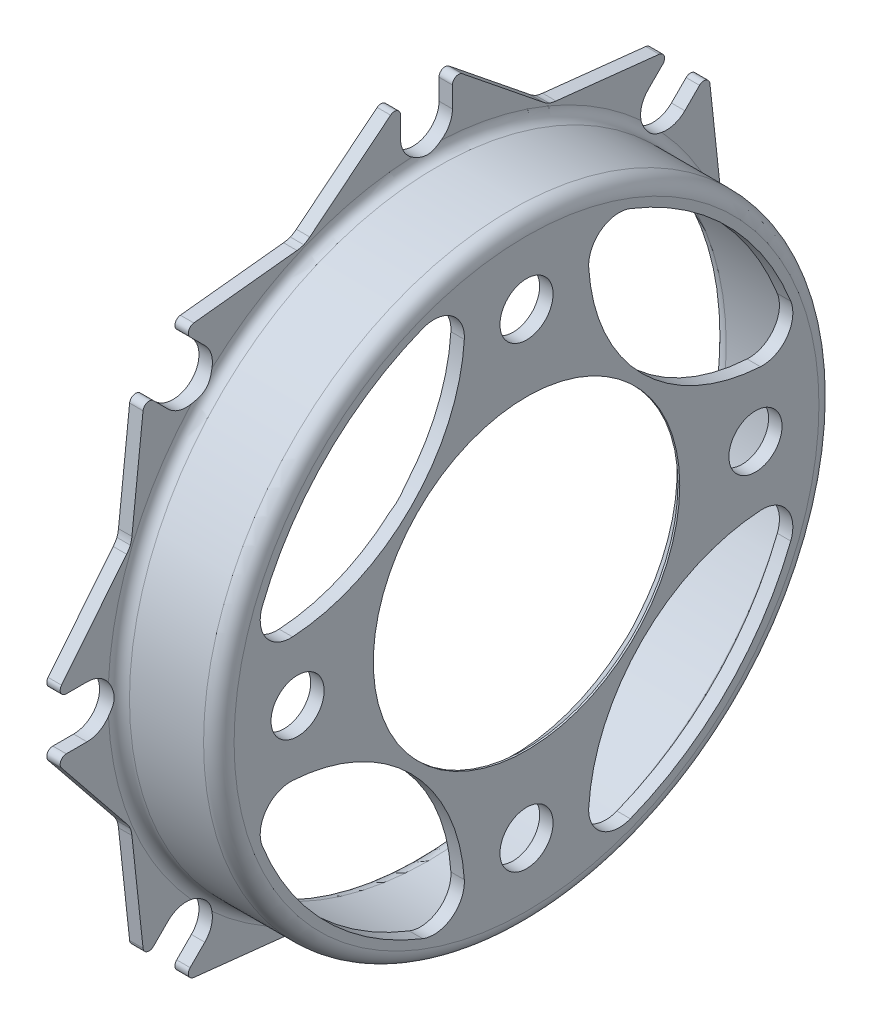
SolidWorks part; units mm, degrees
ref_plane "Front Plane" through (0, 0, 0) normal (0, 0, 1) x (1, 0, 0)
ref_plane "Top Plane" through (0, 0, 0) normal (0, 1, 0) x (1, 0, 0)
ref_plane "Right Plane" through (0, 0, 0) normal (1, 0, 0) x (0, 0, -1)
sketch "Sketch1" plane through (0, 0, 0) normal (0, 0, 1) x (1, 0, 0)
  line L0 (20.8102, 34.1272) -> (20.8102, 59.7535)
  line L1 (18.5877, 61.976) -> (3.175, 61.976)
  line L2 (0, 65.151) -> (0, 88.9)
  line L3 (0, 88.9) -> (2.794, 88.9)
  line L4 (2.794, 88.9) -> (2.794, 66.2305)
  line L5 (5.0165, 64.008) -> (20.4292, 64.008)
  line L6 (23.6042, 60.833) -> (23.6042, 31.877)
  line L7 (23.6042, 31.877) -> (23.2232, 31.877)
  line L8 (20.8102, 34.1272) -> (23.2232, 31.877)
  arc A0 (20.4292, 64.008) -> (23.6042, 60.833) centre (20.4292, 60.833) cw
  arc A1 (18.5877, 61.976) -> (20.8102, 59.7535) centre (18.5877, 59.7535) cw
  arc A2 (0, 65.151) -> (3.175, 61.976) centre (3.175, 65.151) ccw
  arc A3 (2.794, 66.2305) -> (5.0165, 64.008) centre (5.0165, 66.2305) ccw
  dimension "D8" = 3.175
  dimension "D9" = 2.2225
  dimension "D10" = 0.381
  dimension "D1" = 64.008
  dimension "D2" = 88.9
  dimension "D3" = 2.032
  dimension "D4" = 2.794
  dimension "D5" = 2.794
  dimension "D6" = 31.877
  dimension "D7" = 23.6042
  dimension "D11" = 47
ref_axis "Axis1" through (25.8699, 0, 0) along (-1, 0, 0)
revolve "Revolve1" add sketch "Sketch1" angle 360 about axis through (25.8699, 0, 0) along (-1, 0, 0)
sketch "Sketch2" plane through (23.6042, 0, 0) normal (1, 0, 0) x (0, 0, -1)
  circle A0 centre (0, 47.625) radius 5.5245
  dimension "D2" = 11.049
  dimension "D1" = 47.625
extrude "Cut-Extrude1" cut sketch "Sketch2" against normal up to next
pattern_circular "CirPattern1" count 4 every 90 about axis through (0, 0, 0) along (1, 0, 0) of "Cut-Extrude1"
sketch "Sketch3" plane through (23.6042, 0, 0) normal (1, 0, 0) x (0, 0, -1)
  line L0 (0, 0) -> (13.5385, 63.6938) construction
  line L1 (0, 0) -> (60.3937, 12.8371) construction
  line L2 (0, 0) -> (0, 62.2775) construction
  line L3 (0, 0) -> (59.5435, 0) construction
  arc A0 (54.9619, 21.6027) -> (21.6027, 54.9619) centre (0, 0) ccw
  arc A1 (12.9415, 48.6681) -> (48.6681, 12.9415) centre (50.9718, 50.9718) ccw
  arc A2 (12.9415, 48.6681) -> (21.6027, 54.9619) centre (19.2799, 49.0521) cw
  arc A3 (54.9619, 21.6027) -> (48.6681, 12.9415) centre (49.0521, 19.2799) cw
  point P15 (-64.0983, -8.6683)
  dimension "D1" = 12
  dimension "D2" = 12
  dimension "D7" = 2.54
  dimension "D3" = 59.055
  dimension "D5" = 2.54
  dimension "D6" = 38.1
  dimension "D4" = 6.35
extrude "Cut-Extrude2" cut sketch "Sketch3" against normal up to next
pattern_circular "CirPattern2" count 4 every 90 about axis through (0, 0, 0) along (1, 0, 0) of "Cut-Extrude2"
sketch "Sketch5" plane through (0, 0, 0) normal (-1, 0, 0) x (0, 0, 1)
  line L0 (-7.464, 75.9192) -> (-24.2802, 62.3787)
  line L1 (7.464, 75.9192) -> (24.2802, 62.3787)
  line L2 (-5.3975, 74.93) -> (-5.3975, 70.612)
  line L3 (5.3975, 70.612) -> (5.3975, 74.93)
  line L4 (0, 0) -> (-61.2529, 147.8776) construction
  line L5 (0, 0) -> (61.0786, 147.4569) construction
  line L6 (0, 0) -> (0, 165.0951) construction
  line L7 (-34.0206, 82.1329) -> (-25.5154, 61.5997)
  line L8 (34.0206, 82.1329) -> (25.5154, 61.5997)
  arc A0 (-5.3975, 74.93) -> (-7.464, 75.9192) centre (-6.6675, 74.93) ccw
  arc A2 (-5.3975, 70.612) -> (5.3975, 70.612) centre (0, 70.612) ccw
  arc A3 (7.464, 75.9192) -> (5.3975, 74.93) centre (6.6675, 74.93) ccw
  circle A5 centre (0, 0) radius 88.9 construction
  arc A8 (-24.2802, 62.3787) -> (-25.5154, 61.5997) centre (-28.2627, 67.3246) cw
  arc A9 (34.0206, 82.1329) -> (-34.0206, 82.1329) centre (0, 0) ccw
  circle A10 centre (0, 0) radius 88.9 construction
  arc A12 (25.5154, 61.5997) -> (24.2802, 62.3787) centre (28.2627, 67.3246) cw
  circle A14 centre (0, 0) radius 66.675 construction
  point P12 (-18.9836, 61.8592)
  dimension "D6" = 1.27
  dimension "D7" = 6.35
  dimension "D5" = 70.612
  dimension "D13" = 74.93
  dimension "D9" = 66.675
  dimension "D2" = 133.35
  dimension "D4" = 66.675
  dimension "D10" = 21.59
  dimension "D3" = 74.93
  dimension "D8" = 10.795
  dimension "D11" = 45
  dimension "D12" = 22.5
  dimension "D14" = 21.59
extrude "Cut-Extrude4" cut sketch "Sketch5" against normal through all
pattern_circular "CirPattern4" count 8 over 360 about axis through (0, 0, 0) along (1, 0, 0) of "Cut-Extrude4"
ref_plane "Plane1" [suppressed] through (0, 0, 0) normal (0, 0.9239, -0.3827) x (-1, 0, 0)
sketch "Sketch6" [suppressed] plane through (0, 0, 0) normal (0, 0.9239, -0.3827) x (1, 0, 0)
  line L0 (18.2766, 11.43) -> (18.2766, -11.43)
  line L2 (7.1641, -11.43) -> (7.1641, 11.43)
  line L4 (20.4292, 64.008) -> (20.4292, -64.008) construction
  arc A0 (18.2766, 11.43) -> (7.1641, 11.43) centre (12.7203, 11.43) ccw
  arc A1 (7.1641, -11.43) -> (18.2766, -11.43) centre (12.7203, -11.43) ccw
  dimension "D3" = 7.1641
  dimension "D5" = 5.5562
  dimension "D6" = 5.5562
  dimension "D1" = 11.1125
  dimension "D2" = 2.1526
  dimension "D4" = 22.86
  dimension "D7" = 11.43
extrude "Cut-Extrude5" [suppressed] cut sketch "Sketch6" against normal up to next
pattern_circular "CirPattern5" [suppressed] count 8 over 360 about axis through (25.8699, 0, 0) along (-1, 0, 0)
